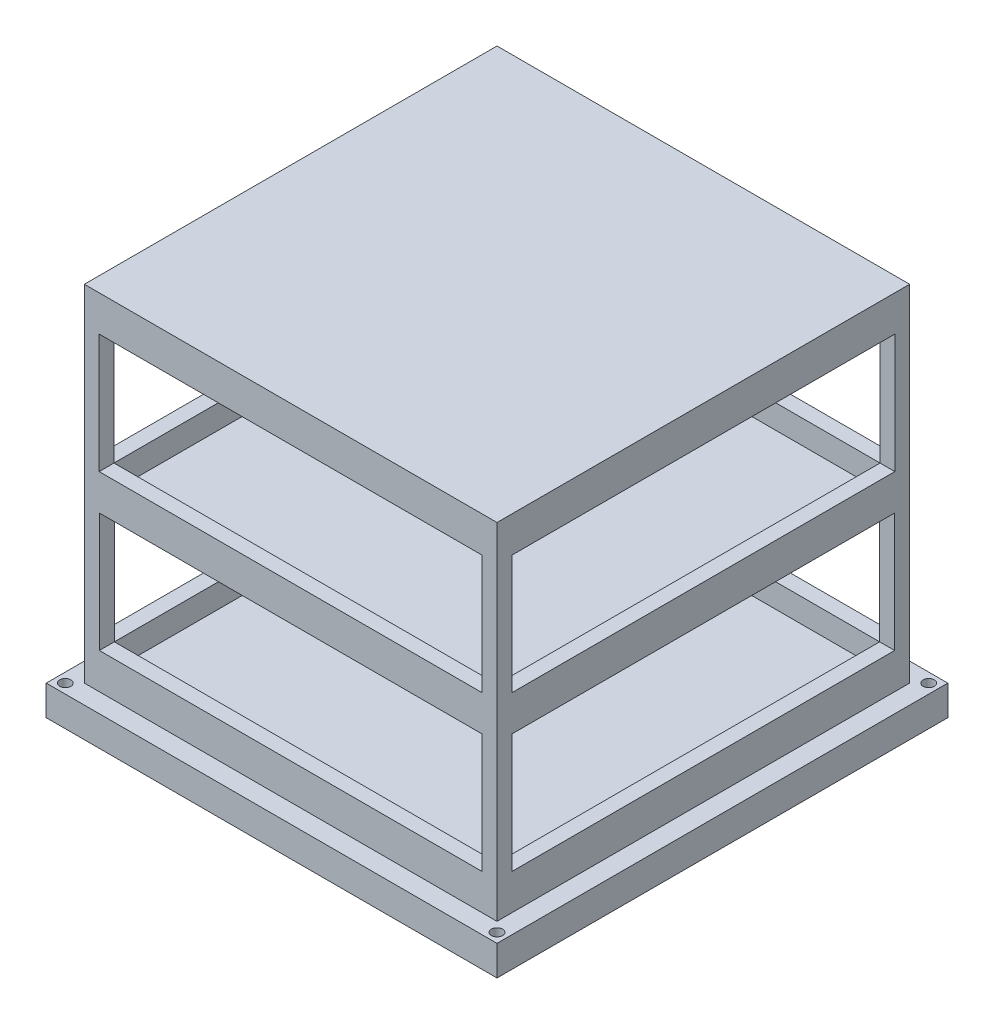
SolidWorks part; units mm, degrees
ref_plane "Front Plane" through (0, 0, 0) normal (0, 0, 1) x (1, 0, 0)
ref_plane "Top Plane" through (0, 0, 0) normal (0, 1, 0) x (1, 0, 0)
ref_plane "Right Plane" through (0, 0, 0) normal (1, 0, 0) x (0, 0, -1)
sketch "Sketch1" plane through (0, 0, 0) normal (0, 1, 0) x (1, 0, 0)
  line L1 (-55, -55) -> (55, -55)
  line L2 (-55, -55) -> (-55, 55)
  line L3 (-55, 55) -> (55, 55)
  line L4 (55, -55) -> (55, 55)
  line L5 (-55, -55) -> (55, 55) construction
  line L6 (-55, 55) -> (55, -55) construction
  point P0 (0, 0)
  dimension "D1" = 110
  dimension "D2" = 110
extrude "Boss-Extrude1" add sketch "Sketch1" along normal blind 9.525
sketch "Sketch3" plane through (0, 0, 0) normal (0, -1, 0) x (1, 0, 0)
  line L0 (55, 55) -> (55, -55) construction
  line L1 (-60.08, -60.08) -> (60.08, -60.08)
  line L2 (-60.08, -60.08) -> (-60.08, 60.08)
  line L3 (-60.08, 60.08) -> (60.08, 60.08)
  line L4 (60.08, -60.08) -> (60.08, 60.08)
  line L5 (-60.08, -60.08) -> (60.08, 60.08) construction
  line L6 (-60.08, 60.08) -> (60.08, -60.08) construction
  line L7 (-55, 55) -> (55, 55) construction
  point P0 (0, 0)
  dimension "D1" = 5.08
  dimension "D2" = 5.08
extrude "Boss-Extrude2" add sketch "Sketch3" along normal blind 8
sketch "Sketch4" plane through (0, 0, 0) normal (0, 1, 0) x (1, 0, 0)
  line L0 (-60.08, 60.08) -> (-55, 60.08) construction
  line L1 (-55, 55) -> (-55, 60.08) construction
  line L2 (-60.08, 60.08) -> (60.08, 60.08) construction
  line L3 (0, -5.2388) -> (0, 5.2388) construction
  line L4 (55, 55) -> (55, 60.08) construction
  line L5 (60.08, 60.08) -> (55, 60.08) construction
  line L6 (-5.2388, 0) -> (5.2388, 0) construction
  line L7 (60.08, -60.08) -> (55, -60.08) construction
  line L8 (55, -55) -> (55, -60.08) construction
  line L9 (-55, -55) -> (-55, -60.08) construction
  line L10 (-60.08, -60.08) -> (-55, -60.08) construction
  circle A0 centre (-57.54, 57.54) radius 1.5
  circle A1 centre (57.54, 57.54) radius 1.5
  circle A2 centre (57.54, -57.54) radius 1.5
  circle A3 centre (-57.54, -57.54) radius 1.5
  point P10 (-57.54, 60.08)
  point P11 (-55, 57.54)
  dimension "D1" = 3
extrude "Cut-Extrude2" cut sketch "Sketch4" against normal through all
sketch "Sketch2" plane through (0, 9.525, 0) normal (0, 1, 0) x (1, 0, 0)
  line L1 (-51, -51) -> (51, -51)
  line L2 (-51, -51) -> (-51, 51)
  line L3 (-51, 51) -> (51, 51)
  line L4 (51, -51) -> (51, 51)
  line L5 (-51, -51) -> (51, 51) construction
  line L6 (-51, 51) -> (51, -51) construction
  point P0 (0, 0)
  dimension "D1" = 102
  dimension "D2" = 102
extrude "Cut-Extrude1" cut sketch "Sketch2" against normal blind 6.35
sketch "Sketch5" plane through (0, 9.525, 0) normal (0, 1, 0) x (1, 0, 0)
  line L0 (-5.2388, 0) -> (5.2388, 0) construction
  line L1 (-55, 55) -> (-51, 55)
  line L2 (-55, 55) -> (-55, 51)
  line L3 (-55, 51) -> (-51, 51)
  line L4 (-51, 55) -> (-51, 51)
  line L5 (-55, -51) -> (-51, -51)
  line L6 (-51, -55) -> (-51, -51)
  line L7 (-55, -55) -> (-51, -55)
  line L8 (-55, -55) -> (-55, -51)
  line L9 (0, -5.2388) -> (0, 5.2388) construction
  line L10 (55, -55) -> (55, -51)
  line L11 (55, -55) -> (51, -55)
  line L12 (51, -55) -> (51, -51)
  line L13 (55, -51) -> (51, -51)
  line L14 (55, 51) -> (51, 51)
  line L15 (51, 55) -> (51, 51)
  line L16 (55, 55) -> (51, 55)
  line L17 (55, 55) -> (55, 51)
extrude "Boss-Extrude3" add sketch "Sketch5" along normal blind 31.75
sketch "Sketch6" plane through (0, 41.275, 0) normal (0, 1, 0) x (1, 0, 0)
  line L1 (-55, 55) -> (55, 55)
  line L2 (-55, 55) -> (-55, -55)
  line L3 (-55, -55) -> (55, -55)
  line L4 (55, 55) -> (55, -55)
extrude "Boss-Extrude4" add sketch "Sketch6" along normal blind 9.525
sketch "Sketch7" plane through (0, 50.8, 0) normal (0, 1, 0) x (1, 0, 0)
  line L1 (-51.054, -51.054) -> (51.054, -51.054)
  line L2 (-51.054, -51.054) -> (-51.054, 51.054)
  line L3 (-51.054, 51.054) -> (51.054, 51.054)
  line L4 (51.054, -51.054) -> (51.054, 51.054)
  line L5 (-51.054, -51.054) -> (51.054, 51.054) construction
  line L6 (-51.054, 51.054) -> (51.054, -51.054) construction
  point P0 (0, 0)
  dimension "D1" = 102.108
  dimension "D2" = 102.108
extrude "Cut-Extrude3" cut sketch "Sketch7" against normal blind 6.35
sketch "Sketch8" plane through (0, 50.8, 0) normal (0, 1, 0) x (1, 0, 0)
  line L0 (0, -5.2388) -> (0, 5.2388) construction
  line L1 (-55, 55) -> (-51.054, 55)
  line L2 (-55, 55) -> (-55, 51.054)
  line L3 (-55, 51.054) -> (-51.054, 51.054)
  line L4 (-51.054, 55) -> (-51.054, 51.054)
  line L5 (55, 51.054) -> (51.054, 51.054)
  line L6 (51.054, 55) -> (51.054, 51.054)
  line L7 (55, 55) -> (51.054, 55)
  line L8 (55, 55) -> (55, 51.054)
  line L9 (-5.2388, 0) -> (5.2388, 0) construction
  line L10 (55, -55) -> (55, -51.054)
  line L11 (55, -55) -> (51.054, -55)
  line L12 (51.054, -55) -> (51.054, -51.054)
  line L13 (55, -51.054) -> (51.054, -51.054)
  line L14 (-55, -51.054) -> (-51.054, -51.054)
  line L15 (-51.054, -55) -> (-51.054, -51.054)
  line L16 (-55, -55) -> (-51.054, -55)
  line L17 (-55, -55) -> (-55, -51.054)
extrude "Boss-Extrude5" add sketch "Sketch8" along normal blind 31.75
sketch "Sketch9" plane through (0, 82.55, 0) normal (0, 1, 0) x (1, 0, 0)
  line L1 (-55, 55) -> (55, 55)
  line L2 (-55, 55) -> (-55, -55)
  line L3 (-55, -55) -> (55, -55)
  line L4 (55, 55) -> (55, -55)
extrude "Boss-Extrude6" add sketch "Sketch9" along normal blind 9.525
